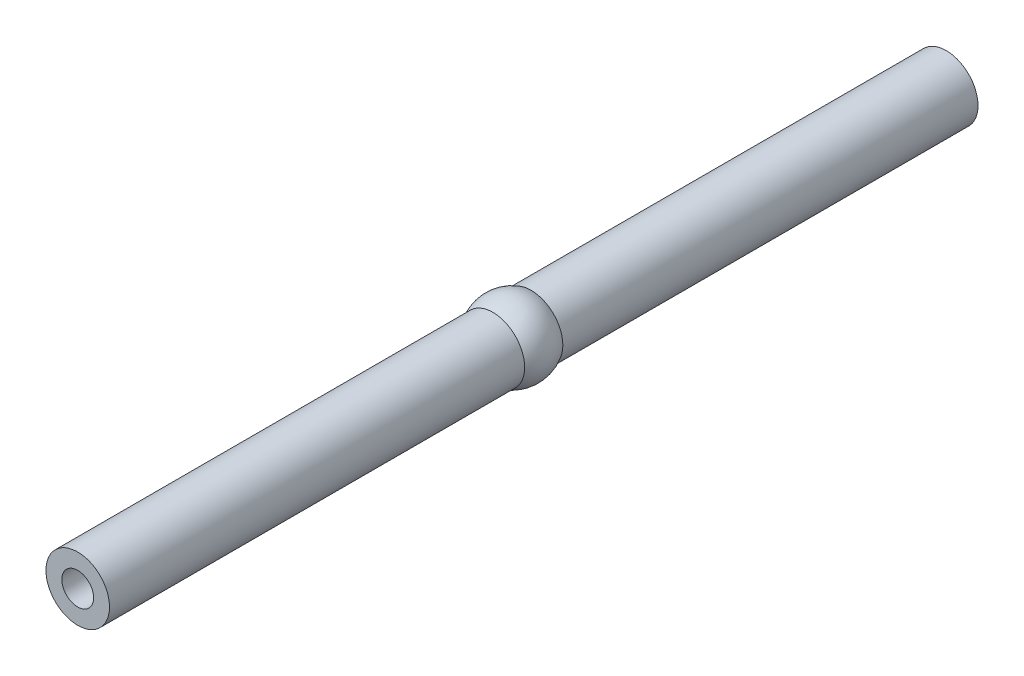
SolidWorks part; units mm, degrees
ref_plane "Face" through (0, 0, 0) normal (0, 0, 1) x (1, 0, 0)
ref_plane "Dessus" through (0, 0, 0) normal (0, 1, 0) x (1, 0, 0)
ref_plane "Droite" through (0, 0, 0) normal (1, 0, 0) x (0, 0, -1)
sketch "Esquisse1" plane through (0, 0, 0) normal (0, 0, 1) x (1, 0, 0)
  circle A0 centre (0, 0) radius 3
  dimension "D1" = 6
extrude "Extrusion1" add sketch "Esquisse1" along normal mid plane 82
sketch "Esquisse2" plane through (0, 0, 41) normal (0, 0, 1) x (1, 0, 0)
  circle A0 centre (0, 0) radius 1.5
  dimension "D1" = 3
extrude "Enlèv. mat.-Extru.1" cut sketch "Esquisse2" against normal blind 10
mirror "Symétrie1" about plane through (0, 0, 0) normal (0, 0, 1)
sketch "Esquisse3" plane through (0, 0, 0) normal (0, 1, 0) x (1, 0, 0)
  line L0 (0, 20.452) -> (0, -17.9417) construction
  line L1 (0, -3.5) -> (0, 3.5)
  arc A0 (0, 3.5) -> (0, -3.5) centre (0, 0) ccw
  dimension "D1" = 7
revolve "Révolution1" add sketch "Esquisse3" angle 360 about L0
